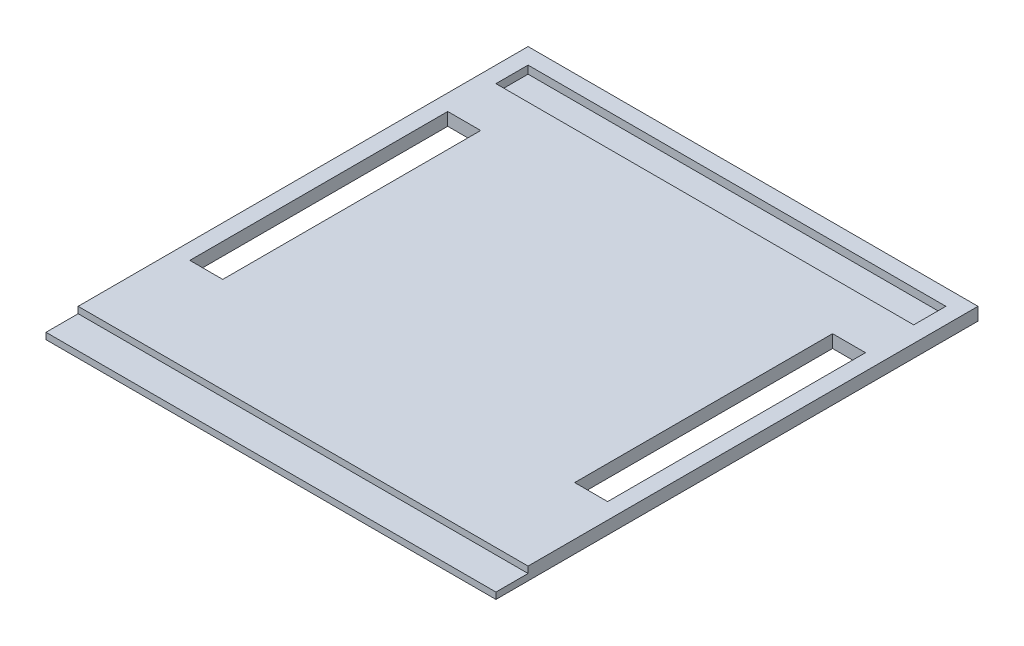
SolidWorks part; units mm, degrees
ref_plane "Front Plane" through (0, 0, 0) normal (0, 0, 1) x (1, 0, 0)
ref_plane "Top Plane" through (0, 0, 0) normal (0, 1, 0) x (1, 0, 0)
ref_plane "Right Plane" through (0, 0, 0) normal (1, 0, 0) x (0, 0, -1)
sketch "Sketch2" plane through (0, 0, 0) normal (0, 1, 0) x (1, 0, 0)
  line L0 (-70, 70) -> (70, 70) construction
  line L1 (-70, 210) -> (70, 210)
  line L2 (-70, 210) -> (-70, -210)
  line L3 (-70, -210) -> (70, -210)
  line L4 (70, 210) -> (70, -210)
  line L5 (-70, 210) -> (70, -210) construction
  line L6 (-70, -210) -> (70, 210) construction
  point P0 (0, 0)
  dimension "D1" = 420
  dimension "D2" = 140
  dimension "D3" = 280
extrude "Boss-Extrude1" add sketch "Sketch2" along normal blind 4
sketch "Sketch3" plane through (0, 4, 0) normal (0, 1, 0) x (1, 0, 0)
  line L0 (0, 0) -> (0, -210) construction
  line L1 (-37.5, -165) -> (-37.5, -145)
  line L2 (-37.5, -145) -> (-43.5, -145)
  line L3 (-43.5, -145) -> (-43.5, -165)
  line L4 (70, -210) -> (70, 210)
  line L5 (70, 210) -> (-70, 210)
  line L6 (-70, 210) -> (-70, -210)
  line L7 (-70, -210) -> (70, -210)
  line L8 (70, -210) -> (70, 210)
  line L9 (70, 210) -> (-70, 210)
  line L10 (-70, 210) -> (-70, -210)
  line L11 (-70, -210) -> (70, -210)
  line L12 (37.5, -165) -> (37.5, -145)
  line L13 (37.5, -145) -> (43.5, -145)
  line L14 (43.5, -145) -> (43.5, -165)
  line L15 (-37.5, -165) -> (37.5, -165) construction
  arc A0 (-37.5, -165) -> (37.5, -165) centre (0, -165) ccw
  arc A1 (-43.5, -165) -> (43.5, -165) centre (0, -165) ccw
  dimension "D2" = 37.5
  dimension "D3" = 6
  dimension "D4" = 6
  dimension "D5" = 45
  dimension "D6" = 6
  dimension "D7" = 20
  dimension "D8" = 20
  dimension "D1" = 0
extrude "Boss-Extrude2" add sketch "Sketch3" along normal blind 25 contours L3 A1 L14 L13 L12 A0 L1 L2
sketch "Sketch4" plane through (0, 4, 0) normal (0, 1, 0) x (1, 0, 0)
  line L1 (-65, 180) -> (-54.75, 180)
  line L2 (-65, 180) -> (-65, 99.75)
  line L3 (-65, 99.75) -> (-54.75, 99.75)
  line L4 (-54.75, 180) -> (-54.75, 99.75)
  line L5 (-65, 180) -> (-54.75, 99.75) construction
  line L6 (-65, 99.75) -> (-54.75, 180) construction
  line L7 (54.75, 180) -> (65, 180)
  line L8 (54.75, 180) -> (54.75, 99.75)
  line L9 (54.75, 99.75) -> (65, 99.75)
  line L10 (65, 180) -> (65, 99.75)
  line L11 (54.75, 180) -> (65, 99.75) construction
  line L12 (54.75, 99.75) -> (65, 180) construction
  line L13 (-70, 210) -> (70, 210) construction
  line L14 (-70, 210) -> (-70, -210) construction
  line L15 (70, 210) -> (70, -210) construction
  point P4 (-59.875, 139.875)
  point P9 (59.875, 139.875)
  dimension "D1" = 10.25
  dimension "D2" = 10.25
  dimension "D3" = 80.25
  dimension "D4" = 80.25
  dimension "D5" = 30
  dimension "D6" = 30
  dimension "D7" = 5
  dimension "D8" = 5
extrude "Cut-Extrude1" cut sketch "Sketch4" against normal blind 25.4
sketch "Sketch6" plane through (0, 4, 0) normal (0, 1, 0) x (1, 0, 0)
  line L0 (-65, 99.75) -> (-54.75, 99.75) construction
  line L1 (-65, 99.75) -> (-54.75, 99.75)
  line L2 (0, -202.5) -> (0, 99.75) construction
  line L3 (0, 99.75) -> (-54.75, 99.75) construction
  arc A0 (-37.5, -165) -> (37.5, -165) centre (0, -165) ccw construction
  arc A1 (-37.5, -165) -> (37.5, -165) centre (0, -165) ccw
  point P5 (0, -202.5)
  dimension "D1" = 302.25
sketch "Sketch7" plane through (0, 4, 0) normal (0, 1, 0) x (1, 0, 0)
  line L0 (70, 210) -> (-70, 210) construction
  line L1 (-65, 205) -> (65, 205)
  line L2 (-65, 205) -> (-65, 195)
  line L3 (-65, 195) -> (65, 195)
  line L4 (65, 205) -> (65, 195)
  line L5 (-65, 205) -> (65, 195) construction
  line L6 (-65, 195) -> (65, 205) construction
  line L7 (-70, 210) -> (-70, -210) construction
  line L8 (70, -210) -> (70, 210) construction
  point P4 (0, 200)
  dimension "D1" = 5
  dimension "D2" = 5
  dimension "D3" = 5
  dimension "D4" = 10
extrude "Cut-Extrude2" cut sketch "Sketch7" against normal blind 2.45 contours L3 L4 L1 L2
sketch "Sketch9" plane through (0, 0, 0) normal (0, -1, 0) x (1, 0, 0)
  line L0 (-70, 70) -> (70, 70)
  line L1 (-70, -70) -> (70, -70)
  line L4 (70, -210) -> (70, 210)
  line L5 (70, 210) -> (-70, 210)
  line L6 (-70, 210) -> (-70, -210)
  line L7 (-70, -210) -> (70, -210)
  line L8 (70, -210) -> (70, 210)
  line L9 (70, 210) -> (-70, 210)
  line L10 (-70, 210) -> (-70, -210)
  line L11 (-70, -210) -> (70, -210)
  dimension "D2" = 140
  dimension "D3" = 140
  dimension "D1" = 0
extrude "Cut-Extrude3" cut sketch "Sketch9" against normal through all and the other way through all contours L1 L0 M17 M15 | L0 M17 M15 M16
sketch "Sketch10" plane through (0, 0, 0) normal (0, 1, 0) x (1, 0, 0)
  line L0 (70, 70) -> (70, 210) construction
  line L1 (-70, 70) -> (70, 70)
  line L2 (-70, 70) -> (-70, 60)
  line L3 (-70, 60) -> (70, 60)
  line L4 (70, 70) -> (70, 60)
  line L5 (-70, 70) -> (70, 60) construction
  line L6 (-70, 60) -> (70, 70) construction
  point P4 (0, 65)
  dimension "D1" = 10
extrude "Boss-Extrude3" add sketch "Sketch10" along normal blind 2
